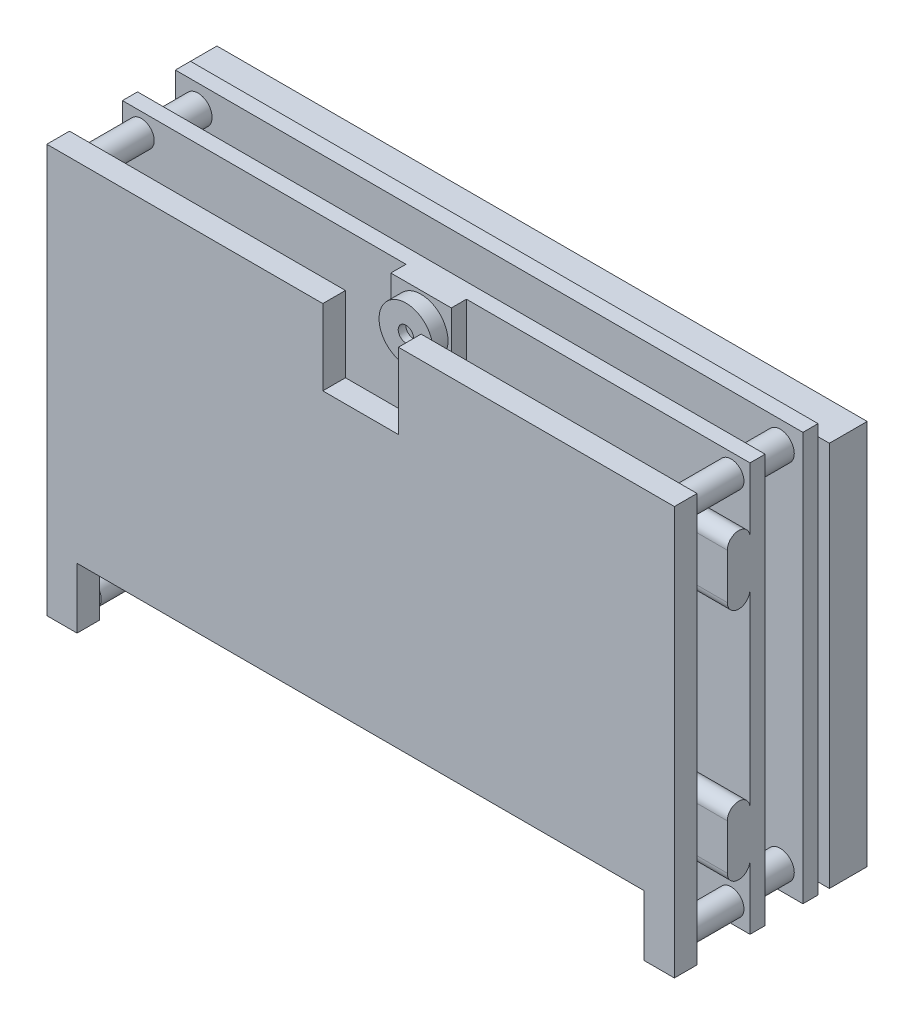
SolidWorks part; units mm, degrees
ref_plane "前视基准面" through (0, 0, 0) normal (0, 0, 1) x (1, 0, 0)
ref_plane "上视基准面" through (0, 0, 0) normal (0, 1, 0) x (1, 0, 0)
ref_plane "右视基准面" through (0, 0, 0) normal (1, 0, 0) x (0, 0, -1)
sketch "草图1" plane through (0, 0, 0) normal (0, 0, 1) x (1, 0, 0)
  line L1 (-41.5, 27) -> (41.5, 27)
  line L2 (-41.5, 27) -> (-41.5, -27)
  line L3 (-41.5, -27) -> (41.5, -27)
  line L4 (41.5, 27) -> (41.5, -27)
  line L5 (-41.5, 27) -> (41.5, -27) construction
  line L6 (-41.5, -27) -> (41.5, 27) construction
  point P0 (0, 0)
  dimension "D1" = 54
  dimension "D2" = 83
extrude "凸台-拉伸1" add sketch "草图1" along normal blind 3
sketch "草图2" plane through (0, 0, 0) normal (0, 0, -1) x (-1, 0, 0)
  line L0 (-41.5, 27) -> (41.5, -27) construction
  line L1 (41.5, 27) -> (-41.5, -27) construction
  line L2 (0, 31.4972) -> (0, -5.8698) construction
  line L3 (-41.5, 27) -> (41.5, 27) construction
  line L4 (-5, 17) -> (5, 17)
  line L5 (-5, 17) -> (-5, 27)
  line L6 (-5, 27) -> (5, 27)
  line L7 (5, 17) -> (5, 27)
  line L8 (-5, 17) -> (5, 27) construction
  line L9 (-5, 27) -> (5, 17) construction
  point P10 (0, 22)
  dimension "D1" = 10
  dimension "D2" = 10
extrude "切除-拉伸1" cut sketch "草图2" against normal through all
sketch "草图3" plane through (0, 0, 0) normal (0, 0, -1) x (-1, 0, 0)
  line L0 (-16.5, -27) -> (37.5, -27)
  line L1 (-16.5, -19) -> (37.5, -19)
  line L2 (37.5, -19) -> (37.5, -27)
  line L3 (41.5, 27) -> (41.5, -27) construction
  line L4 (-16.5, -19) -> (-16.5, -27)
  line L5 (-41.5, -19) -> (41.5, -19) construction
  line L6 (-41.5, -27) -> (41.5, -27) construction
  line L8 (41.5, -27) -> (-41.5, -27) construction
  dimension "D2" = 4
  dimension "D1" = 8
  dimension "D3" = 54
extrude "切除-拉伸2" cut sketch "草图3" against normal through all
sketch "草图4" plane through (0, 0, 0) normal (0, 0, -1) x (-1, 0, 0)
  line L0 (-41.5, 27) -> (41.5, -27) construction
  line L1 (41.5, 27) -> (-41.5, -27) construction
  line L2 (0, 43.0826) -> (0, -36.316) construction
  line L3 (-39, 24.5) -> (39, 24.5) construction
  line L4 (-39, 24.5) -> (-39, -24.5) construction
  line L5 (-39, -24.5) -> (39, -24.5) construction
  line L6 (39, 24.5) -> (39, -24.5) construction
  line L7 (-39, 24.5) -> (39, -24.5) construction
  line L8 (-39, -24.5) -> (39, 24.5) construction
  line L9 (-62.128, 0) -> (67.1687, 0) construction
  circle A0 centre (-39, 24.5) radius 1.7
  circle A1 centre (39, 24.5) radius 1.7
  circle A2 centre (39, -24.5) radius 1.7
  circle A3 centre (-39, -24.5) radius 1.7
  point P8 (0, 0)
  dimension "D3" = 3.4
  dimension "D1" = 49
  dimension "D2" = 78
extrude "凸台-拉伸2" add sketch "草图4" along normal blind 7
sketch "草图5" plane through (0, 0, -7) normal (0, 0, -1) x (-1, 0, 0)
  line L1 (-41.5, -27) -> (41.5, -27)
  line L2 (-41.5, -27) -> (-41.5, 27)
  line L3 (-41.5, 27) -> (41.5, 27)
  line L4 (41.5, -27) -> (41.5, 27)
  line L5 (-41.5, -27) -> (41.5, 27) construction
  line L6 (-41.5, 27) -> (41.5, -27) construction
  point P0 (0, 0)
extrude "凸台-拉伸3" add sketch "草图5" along normal blind 2
sketch "草图6" plane through (0, 0, -7) normal (0, 0, 1) x (1, 0, 0)
  line L0 (0, 31.574) -> (0, -32.1111) construction
  line L1 (-41.5, 27) -> (41.5, 27) construction
  line L2 (-4, 19) -> (4, 19)
  line L3 (-4, 19) -> (-4, 27)
  line L4 (-4, 27) -> (4, 27)
  line L5 (4, 19) -> (4, 27)
  line L6 (-4, 19) -> (4, 27) construction
  line L7 (-4, 27) -> (4, 19) construction
  point P3 (0, 23)
  dimension "D1" = 8
  dimension "D2" = 8
extrude "凸台-拉伸4" add sketch "草图6" along normal blind 2
sketch "草图7" plane through (0, 0, -5) normal (0, 0, 1) x (1, 0, 0)
  line L0 (-4, 19) -> (4, 27) construction
  line L1 (4, 19) -> (-4, 27) construction
  circle A0 centre (0, 23) radius 3.5594
  dimension "D1" = 7.1188
extrude "凸台-拉伸5" add sketch "草图7" along normal blind 2
sketch "草图8" plane through (0, 0, -3) normal (0, 0, 1) x (1, 0, 0)
  circle A0 centre (0, 23) radius 1.0229
  dimension "D1" = 2.0458
extrude "切除-拉伸3" cut sketch "草图8" against normal blind 1
mirror "镜向1" about plane through (0, 0, 0) normal (1, 0, 0) of "切除-拉伸2"
ref_plane "基准面1" through (41.5, 0, 0) normal (1, 0, 0) x (0, 0, -1)
sketch "草图10" plane through (41.5, 0, 0) normal (1, 0, 0) x (0, 0, -1)
  line L0 (5.5, 18.5) -> (5.5, 12.5) construction
  line L1 (7, 18.5) -> (7, 12.5)
  line L2 (4, 18.5) -> (4, 12.5)
  line L3 (9, 27) -> (7, 27) construction
  line L4 (7, 27) -> (7, -27) construction
  arc A0 (7, 18.5) -> (4, 18.5) centre (5.5, 18.5) ccw
  arc A1 (4, 12.5) -> (7, 12.5) centre (5.5, 12.5) ccw
  point P2 (5.5, 15.5)
  dimension "D1" = 1.5
  dimension "D2" = 6
  dimension "D3" = 8.5
extrude "凸台-拉伸6" add sketch "草图10" against normal blind 7
mirror "镜向2" about plane through (0, 0, 0) normal (0, 1, 0) of "凸台-拉伸6"
sketch "草图11" plane through (-41.5, 0, 0) normal (-1, 0, 0) x (0, 0, 1)
  line L0 (0, -29.7) -> (0, 29.7) construction
  line L1 (-11, 5) -> (0, 5)
  line L2 (-11, 5) -> (-11, -11)
  line L3 (-11, -11) -> (0, -11)
  line L4 (0, 5) -> (0, -11)
  line L5 (-11, 5) -> (0, -11) construction
  line L6 (-11, -11) -> (0, 5) construction
  line L7 (-9, -27) -> (-7, -27) construction
  point P0 (-5.5, -3)
  dimension "D1" = 16
  dimension "D2" = 11
  dimension "D3" = 16
extrude "凸台-拉伸7" add sketch "草图11" against normal blind 14
sketch "草图12" plane through (0, 0, -9) normal (0, 0, -1) x (-1, 0, 0)
  line L0 (0, 7.7) -> (0, -7.7) construction
  line L1 (-38.5, 24) -> (38.5, 24) construction
  line L2 (-38.5, 24) -> (-38.5, -24) construction
  line L3 (-38.5, -24) -> (38.5, -24) construction
  line L4 (38.5, 24) -> (38.5, -24) construction
  line L5 (-38.5, 24) -> (38.5, -24) construction
  line L6 (-38.5, -24) -> (38.5, 24) construction
  line L7 (7.7, 0) -> (-7.7, 0) construction
  circle A0 centre (-38.5, 24) radius 1.8574
  circle A1 centre (38.5, 24) radius 1.8574
  circle A2 centre (38.5, -24) radius 1.8574
  circle A3 centre (-38.5, -24) radius 1.8574
  point P0 (0, 0)
  dimension "D3" = 3.7149
  dimension "D1" = 48
  dimension "D2" = 77
extrude "凸台-拉伸8" add sketch "草图12" along normal blind 5
sketch "草图13" plane through (0, 0, -14) normal (0, 0, -1) x (-1, 0, 0)
  line L1 (-41.5, -27) -> (41.5, -27)
  line L2 (-41.5, -27) -> (-41.5, 27)
  line L3 (-41.5, 27) -> (41.5, 27)
  line L4 (41.5, -27) -> (41.5, 27)
  line L5 (-41.5, -27) -> (41.5, 27) construction
  line L6 (-41.5, 27) -> (41.5, -27) construction
  point P0 (0, 0)
extrude "凸台-拉伸9" add sketch "草图13" along normal blind 2
sketch "草图14" plane through (0, 0, -16) normal (0, 0, -1) x (-1, 0, 0)
  line L1 (-43, 25.5) -> (43, 25.5)
  line L2 (-43, 25.5) -> (-43, -25.5)
  line L3 (-43, -25.5) -> (43, -25.5)
  line L4 (43, 25.5) -> (43, -25.5)
  line L5 (-43, 25.5) -> (43, -25.5) construction
  line L6 (-43, -25.5) -> (43, 25.5) construction
  point P1 (0, 0)
  dimension "D1" = 51
  dimension "D2" = 86
extrude "凸台-拉伸10" add sketch "草图14" along normal blind 5
